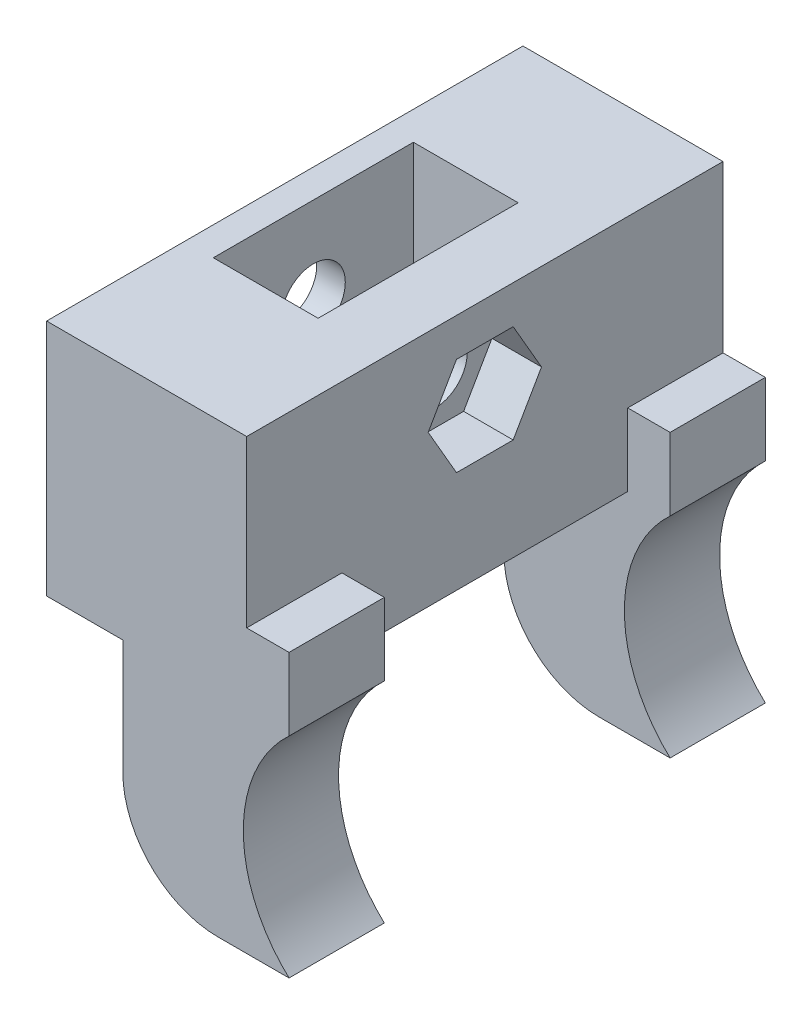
SolidWorks part; units mm, degrees
ref_plane "Front Plane" through (0, 0, 0) normal (0, 0, 1) x (1, 0, 0)
ref_plane "Top Plane" through (0, 0, 0) normal (0, 1, 0) x (1, 0, 0)
ref_plane "Right Plane" through (0, 0, 0) normal (1, 0, 0) x (0, 0, -1)
sketch "Sketch2" plane through (0, 0, 0) normal (0, 0, 1) x (1, 0, 0)
  line L0 (-33, -12.1745) -> (-12, -12.1745)
  line L9 (-12, -12.1745) -> (-12, -29.5727)
  line L10 (-12, -29.5727) -> (-7.5522, -29.5727)
  line L11 (-7.5522, -29.5727) -> (-7.5522, -37.1745)
  line L14 (-25, -37.1745) -> (-25, -49.1745)
  line L15 (-15, -59.1745) -> (-7.5522, -59.1745)
  line L16 (-33, -12.1745) -> (-33, -37.1745)
  line L17 (-33, -37.1745) -> (-25, -37.1745)
  arc A3 (-7.5522, -37.1745) -> (-7.5522, -59.1745) centre (2.6459, -48.1745) ccw
  arc A4 (-15, -59.1745) -> (-25, -49.1745) centre (-15, -49.1745) cw
  point P11 (-25, -59.1745)
  dimension "D9" = 17.4478
  dimension "D8" = 10
  dimension "D6" = 15
  dimension "D2" = 12.1745
  dimension "D3" = 21
  dimension "D4" = 17.3982
  dimension "D5" = 25
  dimension "D7" = 22
  dimension "D10" = 12
  dimension "D11" = 8
extrude "Boss-Extrude1" add sketch "Sketch2" against normal mid plane 50
sketch "Sketch3" plane through (0, -12.1745, 0) normal (0, 1, 0) x (1, 0, 0)
  line L1 (-30, 10.5) -> (-19, 10.5)
  line L2 (-30, 10.5) -> (-30, -10.5)
  line L3 (-30, -10.5) -> (-19, -10.5)
  line L4 (-19, 10.5) -> (-19, -10.5)
  line L5 (-33, 25) -> (-33, -25) construction
  point P4 (-19, 0)
  dimension "D1" = 11
  dimension "D2" = 21
  dimension "D3" = 3
extrude "Cut-Extrude1" cut sketch "Sketch3" against normal blind 18.3 contours L2 L1 L4 L3
sketch "Sketch7" plane through (0, -59.1745, 0) normal (0, -1, 0) x (1, 0, 0)
  line L15 (-40, 15) -> (-7.5522, 15)
  line L16 (-40, 15) -> (-40, -15)
  line L17 (-40, -15) -> (-7.5522, -15)
  line L18 (-7.5522, 15) -> (-7.5522, -15)
  line L19 (-7.5522, -25) -> (-7.5522, 25) construction
  line L20 (-15, 25) -> (-7.5522, 25) construction
  line L21 (-15, -25) -> (-7.5522, -25) construction
  dimension "D1" = 10
  dimension "D2" = 10
  dimension "D3" = 32.4478
extrude "Cut-Extrude3" cut sketch "Sketch7" against normal up to surface (22 mm away)
sketch "Sketch13" plane through (-30, 0, 0) normal (1, 0, 0) x (0, 0, -1)
  line L0 (-10.5, -12.1745) -> (10.5, -30.4745) construction
  line L1 (10.5, -12.1745) -> (-10.5, -30.4745) construction
  circle A0 centre (0, -21.3245) radius 3.35
  dimension "D1" = 6.7
extrude "Cut-Extrude5" cut sketch "Sketch13" against normal through all both and the other way through all
sketch "Sketch14" plane through (-12, 0, 0) normal (1, 0, 0) x (0, 0, -1)
  line L1 (5.9467, -21.3245) -> (2.9734, -16.1745)
  line L2 (2.9734, -16.1745) -> (-2.9734, -16.1745)
  line L3 (-2.9734, -16.1745) -> (-5.9467, -21.3245)
  line L4 (-5.9467, -21.3245) -> (-2.9734, -26.4745)
  line L5 (-2.9734, -26.4745) -> (2.9734, -26.4745)
  line L6 (2.9734, -26.4745) -> (5.9467, -21.3245)
  circle A0 centre (0, -21.3245) radius 5.15 construction
  dimension "D1" = 10.3
extrude "Cut-Extrude6" cut sketch "Sketch14" against normal blind 5.2
sketch "Sketch17" plane through (0, -29.5727, 0) normal (0, 1, 0) x (1, 0, 0)
  line L0 (-12, 25) -> (-12, -25) construction
  line L1 (-12, 15) -> (-7.5522, 15)
  line L2 (-12, 15) -> (-12, -15)
  line L3 (-12, -15) -> (-7.5522, -15)
  line L4 (-7.5522, 15) -> (-7.5522, -15)
  line L5 (-7.5522, 25) -> (-7.5522, -25) construction
  line L6 (-7.5522, 25) -> (-12, 25) construction
  point P8 (-7.5522, 0)
  dimension "D1" = 10
extrude "Cut-Extrude7" cut sketch "Sketch17" against normal up to surface (7.6018 mm away)
